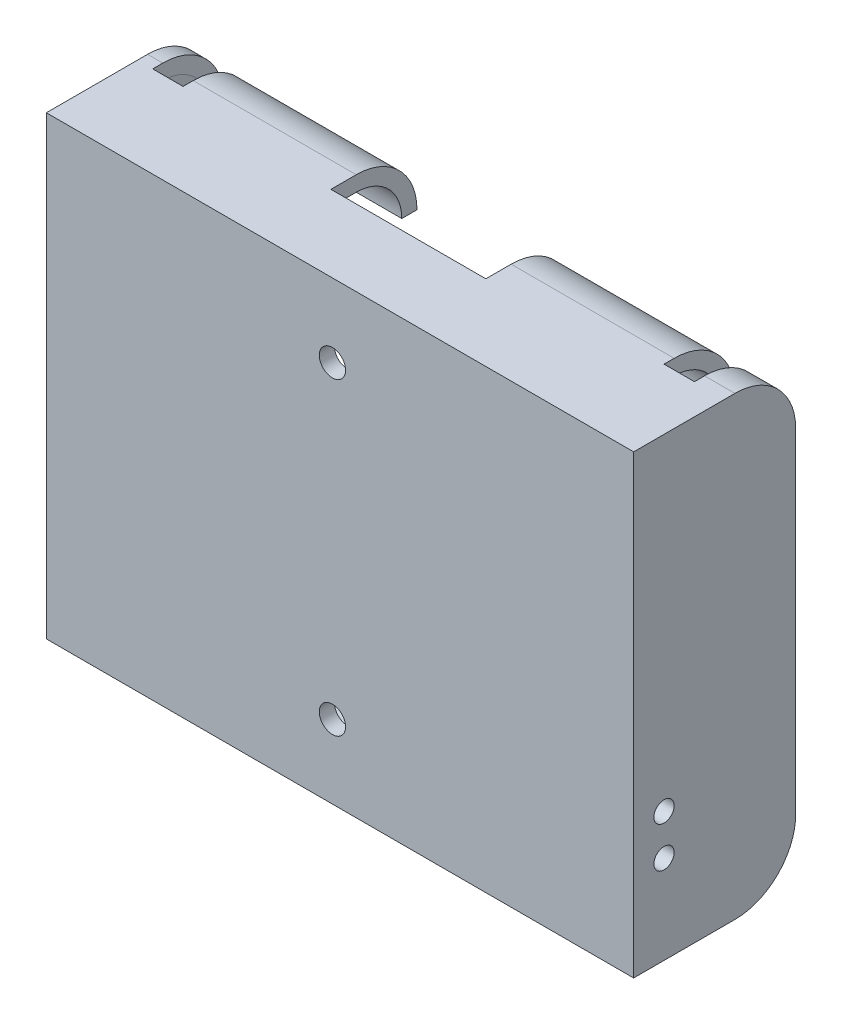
SolidWorks part; units mm, degrees
ref_plane "Face" through (0, 0, 0) normal (0, 0, 1) x (1, 0, 0)
ref_plane "Dessus" through (0, 0, 0) normal (0, 1, 0) x (1, 0, 0)
ref_plane "Droite" through (0, 0, 0) normal (1, 0, 0) x (0, 0, -1)
sketch "Esquisse1" plane through (0, 0, 0) normal (0, 0, 1) x (1, 0, 0)
  line L0 (-28.25, 36.4313) -> (-28.25, -47.0804) construction
  line L1 (29.7456, 41.4313) -> (29.7456, -42.0804) construction
  line L2 (-42.1757, -10.75) -> (43.8582, -10.75) construction
  line L5 (-28.25, 34.25) -> (29.75, 34.25)
  line L6 (-28.25, 34.25) -> (-28.2544, -10.75)
  line L7 (-28.2544, -10.75) -> (29.7456, -10.75)
  line L8 (29.75, 34.25) -> (29.7456, -10.75)
  dimension "D2" = 58
  dimension "D3" = 45
extrude "Base-Extrusion" add sketch "Esquisse1" against normal blind 16
fillet "Congé1" radius 6 2 edges at (0.75, 34.25, -16) (0.7456, -10.75, -16)
shell "Coque1" thickness 1.5
sketch "Esquisse3" plane through (0, 34.25, 0) normal (0, 1, 0) x (-1, 0, 0)
  line L0 (29.248, -9) -> (-31.6408, -9) construction
  line L1 (26.75, -2.27) -> (26.75, -22.4823) construction
  line L2 (-26.75, -2.27) -> (-26.75, -20.7193) construction
  line L3 (12.4989, -7.5) -> (-13.5693, -7.5) construction
  line L4 (0, -0.5699) -> (0, -21.8527) construction
  line L5 (23.75, -7.5) -> (23.75, -19.2081) construction
  line L6 (7.65, -19.2081) -> (7.65, -4.6628) construction
  line L7 (-7.65, -19.2081) -> (-7.65, -4.159) construction
  line L8 (-26.75, -19.2081) -> (-23.75, -19.2081)
  line L9 (26.75, -9) -> (23.75, -9)
  line L10 (26.75, -9) -> (26.75, -19.2081)
  line L11 (26.75, -19.2081) -> (23.75, -19.2081)
  line L12 (23.75, -9) -> (23.75, -19.2081)
  line L13 (7.65, -7.5) -> (-7.65, -7.5)
  line L14 (7.65, -7.5) -> (7.65, -18.3265)
  line L15 (7.65, -18.3265) -> (-7.65, -18.3265)
  line L16 (-7.65, -7.5) -> (-7.65, -18.3265)
  line L17 (-26.75, -9) -> (-26.75, -19.2081)
  line L18 (-26.75, -9) -> (-23.75, -9)
  line L19 (-23.75, -9) -> (-23.75, -19.2081)
extrude "Enlèv. mat.-Extru.2" cut sketch "Esquisse3" against normal through all
sketch "Esquisse4" plane through (29.7466, -0.0029, 0) normal (1, -0.0001, 0) x (0, 0, -1)
  line L0 (-1.5631, 0) -> (18.4717, 0) construction
  line L1 (-1.5631, -2) -> (17.0634, -2) construction
  line L2 (-1.5631, 2) -> (19.7892, 2) construction
  line L3 (3, 3.8616) -> (3, -2.9984) construction
  circle A0 centre (3, 2) radius 1
  circle A1 centre (3, -2) radius 1
extrude "Enlèv. mat.-Extru.3" cut sketch "Esquisse4" against normal blind 6
sketch "Esquisse5" plane through (-41.166, -21.1238, -1.5) normal (0, 0, -1) x (-1, 0, 0)
  line L0 (-69.4138, 32.8738) -> (0, 32.8738) construction
  line L3 (-41.166, 53.8738) -> (-41.166, 0) construction
  line L4 (-33.516, 53.8738) -> (-48.816, 53.8738) construction
  line L5 (-69.4122, 16.3738) -> (-69.4154, 49.3738) construction
  circle A0 centre (-41.166, 48.1238) radius 1.3
  circle A1 centre (-41.166, 17.6238) radius 1.3
  dimension "D1" = 2.6
  dimension "D2" = 30.5
extrude "Enlèv. mat.-Extru.4" cut sketch "Esquisse5" against normal through all
